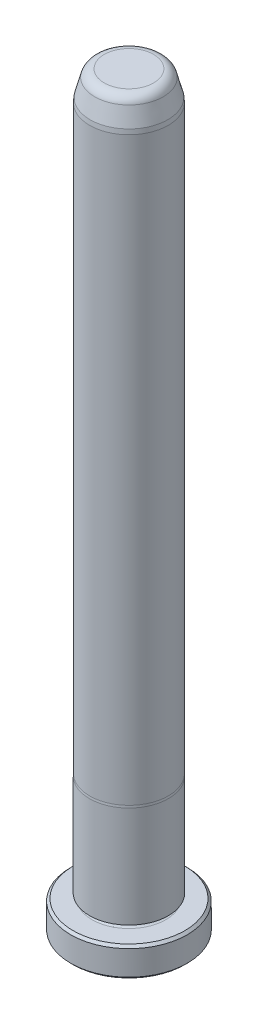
SolidWorks part; units mm, degrees
ref_plane "Front Plane" through (0, 0, 0) normal (0, 0, 1) x (1, 0, 0)
ref_plane "Top Plane" through (0, 0, 0) normal (0, 1, 0) x (1, 0, 0)
ref_plane "Right Plane" through (0, 0, 0) normal (1, 0, 0) x (0, 0, -1)
sketch "Sketch1" plane through (0, 0, 0) normal (1, 0, 0) x (0, 0, -1)
  line L0 (0, 0) -> (9.398, 0)
  line L1 (9.398, 0) -> (9.398, 4.7498)
  line L2 (9.398, 4.7498) -> (5.9563, 4.7498)
  line L3 (5.5753, 4.7498) -> (5.5753, 5.5118) construction
  line L4 (5.9563, 5.5118) -> (6.3627, 5.5118)
  line L5 (6.3627, 5.5118) -> (6.3627, 21.8618)
  line L6 (6.3627, 21.8618) -> (6.3373, 22.225)
  line L7 (6.3373, 22.225) -> (6.3373, 115.9002)
  line L9 (5.2021, 120.65) -> (0, 120.65)
  line L10 (0, 120.65) -> (0, 0)
  line L11 (0, 0) -> (0, -13.6287) construction
  line L12 (6.3373, 115.9002) -> (6.2706, 116.6622)
  line L13 (6.2706, 116.6622) -> (5.2021, 120.65)
  arc A0 (5.9563, 5.5118) -> (5.9563, 4.7498) centre (5.9563, 5.1308) ccw
  dimension "D14" = 0.762
  dimension "T" = 4.7498
  dimension "D2" = 0.762
  dimension "M" = 18.796
  dimension "B" = 12.7254
  dimension "L" = 120.65
  dimension "D7" = 0.7874
  dimension "A" = 22.225
  dimension "D8" = 4
  dimension "D10" = 5
  dimension "D11" = 15
  dimension "D12" = 0.762
  dimension "K" = 4.7498
  dimension "D" = 12.6746
revolve "Revolve1" add sketch "Sketch1" angle 360 about L11
fillet "Fillet6" radius 1.5875 1 edges at (0, 120.65, 5.2021)
chamfer "Chamfer1" distance 0.381 angle 45 2 edges at (0, 0, 9.398) (0, 4.7498, 9.398)
